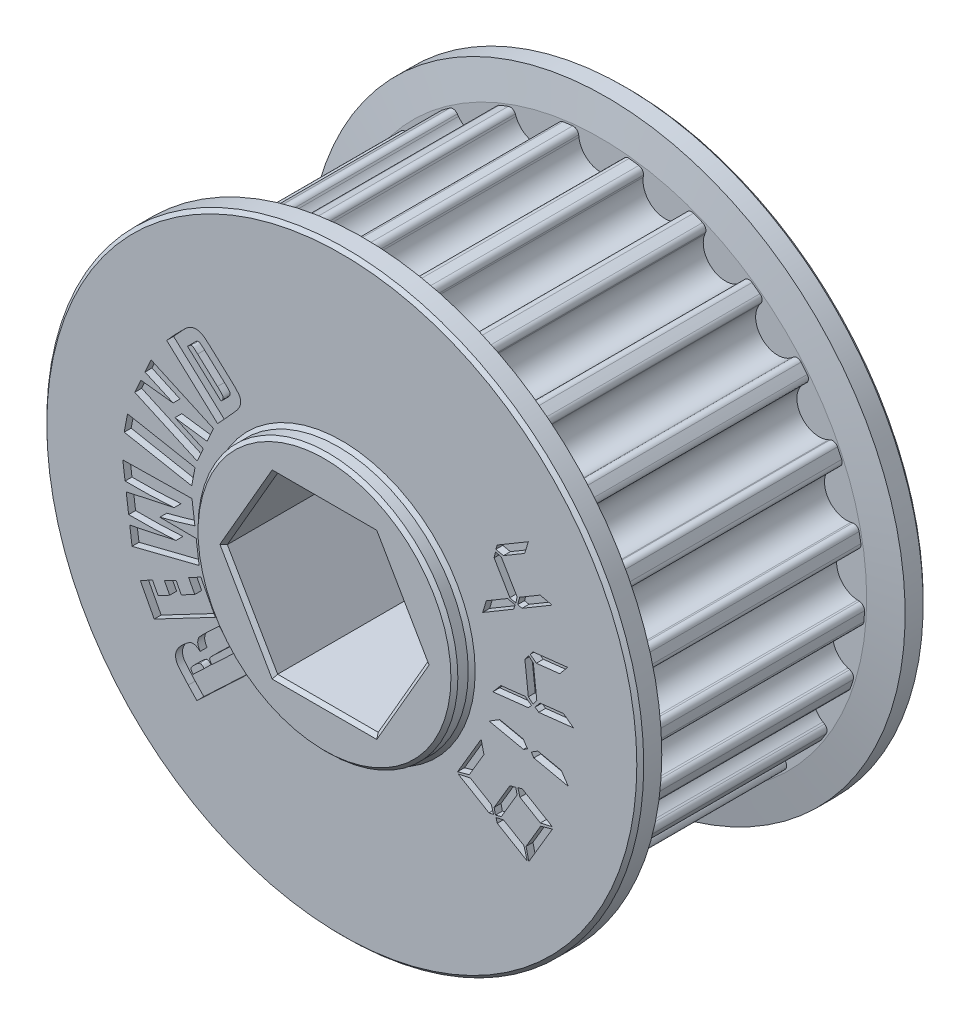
SolidWorks part; units mm, degrees
ref_plane "Front Plane" through (0, 0, 0) normal (0, 0, 1) x (1, 0, 0)
ref_plane "Top Plane" through (0, 0, 0) normal (0, 1, 0) x (1, 0, 0)
ref_plane "Right Plane" through (0, 0, 0) normal (1, 0, 0) x (0, 0, -1)
sketch "Sketch2" plane through (0, 0, 0) normal (0, 0, 1) x (1, 0, 0)
  circle A0 centre (0, 0) radius 19.3468
extrude "pulley" add sketch "Sketch2" along normal mid plane 17
sketch "tooth" plane through (0, 0, 0) normal (0, 0, 1) x (1, 0, 0)
  line L0 (0, 0) -> (0, 18.9468) construction
  line L1 (4.9563, 18.2871) -> (0, 18.9468) construction
  line L2 (4.9563, 18.2871) -> (0, 0) construction
  line L3 (-2.1327, 22.9824) -> (-1.6129, 18.7488)
  line L6 (2.1327, 22.9824) -> (1.6129, 18.7488)
  line L7 (-2.1327, 22.9824) -> (2.1327, 22.9824)
  arc A1 (-1.6129, 18.7488) -> (1.6129, 18.7488) centre (0, 18.9468) ccw
  arc A2 (0, 18.9468) -> (4.9563, 18.2871) centre (0, 0) cw construction
  circle A3 centre (4.9563, 18.2871) radius 1.625 construction
extrude "cut tooth" cut sketch "tooth" against normal mid plane 17
fillet "blend tooth" radius 0.4 2 edges at (1.6774, 19.274, 0) (-1.6774, 19.274, 0)
pattern_circular "tooth pattern" count 25 over 360 about axis through (0, 0, 0) along (0, 0, 1) of "cut tooth", "blend tooth"
sketch "Sketch3" plane through (0, 0, 0) normal (0, 0, 1) x (1, 0, 0)
  circle A0 centre (0, 0) radius 21.8868
  circle A1 centre (0, 0) radius 19.3468 construction
  dimension "D1" = 2.54
extrude "sidewall" add sketch "Sketch3" along normal blind 2 from offset 8.5
mirror "mirror sidewall" about plane through (0, 0, 0) normal (0, 0, 1) of "sidewall"
chamfer "sidewall chamfer" distance 2.4 angle 10 2 edges at (21.8868, 0, 8.5) (21.8868, 0, -8.5)
sketch "Sketch5" plane through (0, 0, 0) normal (0, 0, 1) x (1, 0, 0)
  circle A0 centre (0, 0) radius 9.525
  dimension "D1" = 19.05
extrude "bearing spacer (Manual Suppress)" add sketch "Sketch5" along normal blind 11.77 and the other way blind 11.77
sketch "Sketch4" plane through (0, 0, 0) normal (0, 0, 1) x (1, 0, 0)
  line L1 (3.6882, 6.3881) -> (-3.6882, 6.3881)
  line L2 (-3.6882, 6.3881) -> (-7.3763, 0)
  line L3 (-7.3763, 0) -> (-3.6882, -6.3881)
  line L4 (-3.6882, -6.3881) -> (3.6882, -6.3881)
  line L5 (3.6882, -6.3881) -> (7.3763, 0)
  line L6 (7.3763, 0) -> (3.6882, 6.3881)
  circle A0 centre (0, 0) radius 6.3881 construction
  dimension "D1" = 12.7762
extrude "hex shaft" cut sketch "Sketch4" against normal mid plane 127
chamfer "chamfers" distance 0.254 angle 45 18 edges at (21.8868, 0, -10.5) (21.8868, 0, 10.5) (-9.525, 0, -10.5) (9.525, 0, 10.5) (9.525, 0, 11.77) (0, 6.3881, 11.77) (-5.5323, 3.194, 11.77) (-5.5323, -3.194, 11.77) (0, -6.3881, 11.77) (5.5323, -3.194, 11.77) (5.5323, 3.1941, 11.77) (9.525, 0, -11.77) (0, -6.3881, -11.77) (-5.5323, -3.194, -11.77) (-5.5323, 3.194, -11.77) (0, 6.3881, -11.77) (5.5323, 3.1941, -11.77) (5.5323, -3.194, -11.77)
sketch "SK-VersaCut" plane through (0, 0, 0) normal (0, 0, 1) x (1, 0, 0)
  line B0 (6.3387, 23.6565) -> (5.299, 19.7762)
  line B1 (14.4772, 14.4772) -> (17.3177, 17.3177)
  line B2 (23.6565, 6.3387) -> (19.7762, 5.299)
  line B3 (19.7762, -5.299) -> (23.6565, -6.3387)
  line B4 (17.3177, -17.3177) -> (14.4772, -14.4772)
  line B5 (5.299, -19.7762) -> (6.3387, -23.6565)
  line B6 (-6.3387, -23.6565) -> (-5.299, -19.7762)
  line B7 (-14.4772, -14.4772) -> (-17.3177, -17.3177)
  line B8 (-23.6565, -6.3387) -> (-19.7762, -5.299)
  line B9 (-19.7762, 5.299) -> (-23.6565, 6.3387)
  line B10 (-17.3177, 17.3177) -> (-14.4772, 14.4772)
  line B11 (-5.299, 19.7762) -> (-6.3387, 23.6565)
  circle B12 centre (0, 23.8125) radius 2.2479
  arc B13 (5.9535, 18.5765) -> (13.1109, 14.4442) centre (0, 0) cw
  arc B14 (7.5904, 24.3458) -> (17.2889, 18.7464) centre (0, 0) cw
  arc B15 (5.9535, 18.5765) -> (5.299, 19.7762) centre (6.2559, 19.5198) cw
  arc B16 (13.1109, 14.4442) -> (14.4772, 14.4772) centre (13.7767, 15.1777) ccw
  arc B17 (17.2889, 18.7464) -> (17.3177, 17.3177) centre (16.6173, 18.0182) cw
  arc B18 (7.5904, 24.3458) -> (6.3387, 23.6565) centre (7.2956, 23.4001) ccw
  circle B19 centre (20.6222, 11.9062) radius 2.2479
  arc B20 (19.0645, 4.1323) -> (19.0645, -4.1323) centre (0, 0) cw
  arc B21 (24.8793, 5.5994) -> (24.8793, -5.5994) centre (0, 0) cw
  arc B22 (19.0645, 4.1323) -> (19.7762, 5.299) centre (20.0326, 4.3422) cw
  arc B23 (19.0645, -4.1323) -> (19.7762, -5.299) centre (20.0326, -4.3422) ccw
  arc B24 (24.8793, -5.5994) -> (23.6565, -6.3387) centre (23.9129, -5.3819) cw
  arc B25 (24.8793, 5.5994) -> (23.6565, 6.3387) centre (23.9129, 5.3819) ccw
  circle B26 centre (20.6222, -11.9063) radius 2.2479
  arc B27 (13.1109, -14.4442) -> (5.9535, -18.5765) centre (0, 0) cw
  arc B28 (17.2889, -18.7464) -> (7.5904, -24.3458) centre (0, 0) cw
  arc B29 (13.1109, -14.4442) -> (14.4772, -14.4772) centre (13.7767, -15.1777) cw
  arc B30 (5.9535, -18.5765) -> (5.299, -19.7762) centre (6.2559, -19.5198) ccw
  arc B31 (7.5904, -24.3458) -> (6.3387, -23.6565) centre (7.2956, -23.4001) cw
  arc B32 (17.2889, -18.7464) -> (17.3177, -17.3177) centre (16.6173, -18.0182) ccw
  circle B33 centre (0, -23.8125) radius 2.2479
  arc B34 (-5.9535, -18.5765) -> (-13.1109, -14.4442) centre (0, 0) cw
  arc B35 (-7.5904, -24.3458) -> (-17.2889, -18.7464) centre (0, 0) cw
  arc B36 (-5.9535, -18.5765) -> (-5.299, -19.7762) centre (-6.2559, -19.5198) cw
  arc B37 (-13.1109, -14.4442) -> (-14.4772, -14.4772) centre (-13.7767, -15.1777) ccw
  arc B38 (-17.2889, -18.7464) -> (-17.3177, -17.3177) centre (-16.6173, -18.0182) cw
  arc B39 (-7.5904, -24.3458) -> (-6.3387, -23.6565) centre (-7.2956, -23.4001) ccw
  circle B40 centre (-20.6222, -11.9063) radius 2.2479
  arc B41 (-19.0645, -4.1323) -> (-19.0645, 4.1323) centre (0, 0) cw
  arc B42 (-24.8793, -5.5994) -> (-24.8793, 5.5994) centre (0, 0) cw
  arc B43 (-19.0645, -4.1323) -> (-19.7762, -5.299) centre (-20.0326, -4.3422) cw
  arc B44 (-19.0645, 4.1323) -> (-19.7762, 5.299) centre (-20.0326, 4.3422) ccw
  arc B45 (-24.8793, 5.5994) -> (-23.6565, 6.3387) centre (-23.9129, 5.3819) cw
  arc B46 (-24.8793, -5.5994) -> (-23.6565, -6.3387) centre (-23.9129, -5.3819) ccw
  circle B47 centre (-20.6222, 11.9063) radius 2.2479
  arc B48 (-13.1109, 14.4442) -> (-5.9535, 18.5765) centre (0, 0) cw
  arc B49 (-17.2889, 18.7464) -> (-7.5904, 24.3458) centre (0, 0) cw
  arc B50 (-13.1109, 14.4442) -> (-14.4772, 14.4772) centre (-13.7767, 15.1777) cw
  arc B51 (-5.9535, 18.5765) -> (-5.299, 19.7762) centre (-6.2559, 19.5198) ccw
  arc B52 (-7.5904, 24.3458) -> (-6.3387, 23.6565) centre (-7.2956, 23.4001) cw
  arc B53 (-17.2889, 18.7464) -> (-17.3177, 17.3177) centre (-16.6173, 18.0182) ccw
sketch_block_instance "VersaKey-1"
sketch_block "Block1" parameters "D1"=47.625, "D2"=4.4958, "D3"=19.5072, "D4"=25.5016, "D6"=0.9906, "D5"=30
extrude "VersaKey (Manual Suppress)" [suppressed] cut sketch "SK-VersaCut" against normal through all both and the other way through all
sketch "Lightening Holes" plane through (0, 0, 0) normal (0, 0, 1) x (1, 0, 0)
  line L0 (-4.2823, 12.4972) -> (-3.9521, 11.9253)
  line L1 (3.9521, 11.9253) -> (4.2823, 12.4972)
  line L14 (0, 0) -> (-3.6662, 6.35) construction
  line L15 (0, 0) -> (0, 6.35) construction
  line L24 (0, 0) -> (3.6662, 6.35) construction
  line L25 (0, 6.35) -> (-3.6662, 6.35) construction
  line L26 (0, 6.35) -> (3.6662, 6.35) construction
  line L27 (-3.0943, 11.43) -> (3.0943, 11.43)
  line L28 (0, 6.35) -> (0, 11.43) construction
  line L29 (8.6817, 9.9572) -> (8.3515, 9.3853)
  line L30 (8.3515, 8.3947) -> (11.4458, 3.0353)
  line L31 (12.3037, 2.54) -> (12.9641, 2.54)
  line L32 (12.9641, -2.54) -> (12.3037, -2.54)
  line L33 (11.4458, -3.0353) -> (8.3515, -8.3947)
  line L34 (8.3515, -9.3853) -> (8.6817, -9.9572)
  line L35 (4.2823, -12.4972) -> (3.9521, -11.9253)
  line L36 (3.0943, -11.43) -> (-3.0943, -11.43)
  line L37 (-3.9521, -11.9253) -> (-4.2823, -12.4972)
  line L38 (-8.6817, -9.9572) -> (-8.3515, -9.3853)
  line L39 (-8.3515, -8.3947) -> (-11.4458, -3.0353)
  line L40 (-12.3037, -2.54) -> (-12.9641, -2.54)
  line L41 (-12.9641, 2.54) -> (-12.3037, 2.54)
  line L42 (-11.4458, 3.0353) -> (-8.3515, 8.3947)
  line L43 (-8.3515, 9.3853) -> (-8.6817, 9.9572)
  arc A3 (-3.6769, 13.9504) -> (3.6769, 13.9504) centre (0, 0) cw
  arc A4 (-3.0943, 11.43) -> (-3.9521, 11.9253) centre (-3.0943, 12.4206) cw
  arc A5 (3.0943, 11.43) -> (3.9521, 11.9253) centre (3.0943, 12.4206) ccw
  arc A6 (3.6769, 13.9504) -> (4.2823, 12.4972) centre (3.4244, 12.9925) cw
  arc A7 (-3.6769, 13.9504) -> (-4.2823, 12.4972) centre (-3.4244, 12.9925) ccw
  arc A72 (10.2429, 10.1595) -> (13.9199, 3.7909) centre (0, 0) cw
  arc A73 (10.2429, 10.1595) -> (8.6817, 9.9572) centre (9.5396, 9.4619) ccw
  arc A74 (8.3515, 8.3947) -> (8.3515, 9.3853) centre (9.2094, 8.89) cw
  arc A75 (13.9199, 3.7909) -> (12.9641, 2.54) centre (12.9641, 3.5306) cw
  arc A76 (13.9199, -3.7909) -> (10.2429, -10.1595) centre (0, 0) cw
  arc A77 (13.9199, -3.7909) -> (12.9641, -2.54) centre (12.9641, -3.5306) ccw
  arc A78 (11.4458, -3.0353) -> (12.3037, -2.54) centre (12.3037, -3.5306) cw
  arc A79 (10.2429, -10.1595) -> (8.6817, -9.9572) centre (9.5396, -9.4619) cw
  arc A80 (3.6769, -13.9504) -> (-3.6769, -13.9504) centre (0, 0) cw
  arc A81 (3.6769, -13.9504) -> (4.2823, -12.4972) centre (3.4244, -12.9925) ccw
  arc A82 (3.0943, -11.43) -> (3.9521, -11.9253) centre (3.0943, -12.4206) cw
  arc A83 (-3.6769, -13.9504) -> (-4.2823, -12.4972) centre (-3.4244, -12.9925) cw
  arc A84 (-10.2429, -10.1595) -> (-13.9199, -3.7909) centre (0, 0) cw
  arc A85 (-10.2429, -10.1595) -> (-8.6817, -9.9572) centre (-9.5396, -9.4619) ccw
  arc A86 (-8.3515, -8.3947) -> (-8.3515, -9.3853) centre (-9.2094, -8.89) cw
  arc A87 (-13.9199, -3.7909) -> (-12.9641, -2.54) centre (-12.9641, -3.5306) cw
  arc A88 (-13.9199, 3.7909) -> (-10.2429, 10.1595) centre (0, 0) cw
  arc A89 (-13.9199, 3.7909) -> (-12.9641, 2.54) centre (-12.9641, 3.5306) ccw
  arc A90 (-11.4458, 3.0353) -> (-12.3037, 2.54) centre (-12.3037, 3.5306) cw
  arc A91 (-10.2429, 10.1595) -> (-8.6817, 9.9572) centre (-9.5396, 9.4619) cw
  arc A92 (11.4458, 3.0353) -> (12.3037, 2.54) centre (12.3037, 3.5306) ccw
  arc A93 (8.3515, -8.3947) -> (8.3515, -9.3853) centre (9.2094, -8.89) ccw
  arc A94 (-3.0943, -11.43) -> (-3.9521, -11.9253) centre (-3.0943, -12.4206) ccw
  arc A95 (-11.4458, -3.0353) -> (-12.3037, -2.54) centre (-12.3037, -3.5306) ccw
  arc A96 (-8.3515, 8.3947) -> (-8.3515, 9.3853) centre (-9.2094, 8.89) ccw
  point P72 (0, 0)
  point P77 (0, 0)
  point P87 (0, 0)
extrude "Lightening Holes (Man Suppress)" [suppressed] cut sketch "Lightening Holes" against normal through all both and the other way through all
sketch "Sketch6" plane through (0, 0, 0) normal (0, 0, 1) x (1, 0, 0)
  line L0 (0, 11.1154) -> (0, 0) construction
  line L1 (0, 0) -> (0, -11.1154) construction
  arc A1 (0, 11.1154) -> (0, -11.1154) centre (0, 0) cw construction
  arc A2 (0, 11.1154) -> (0, -11.1154) centre (0, 0) ccw construction
  text T0 "4419" font "DS-Digital" height in points 24
  text T1 "REWIND" font "Impact" height in points 18
  point P5 (1.2366, 11.1154)
  point P6 (0, 0)
  point P7 (0, 0)
  point P9 (0, 0)
  point P10 (0, 0)
extrude "4419" cut sketch "Sketch6" along normal blind 2.54 from offset 9.992
equation "\"INPUT_pulley_teeth\"= 25"
equation "\"pulley_c2c\"= 5mm"
equation "\"pulley_teeth_deg\"= 360 / \"INPUT_pulley_teeth\""
equation "\"pulley_radius\"= ( \"pulley_c2c\" / ( 2 * cos ( \"iso_half_angle\" ) ) ) - 1mm"
equation "\"iso_half_angle\"= ( 180 - \"pulley_teeth_deg\" ) / 2"
equation "\"D1@tooth\" = \"pulley_radius\""
equation "\"pulley_tooth_dia\"= 3.25mm"
equation "\"D3@tooth\"=\"pulley_c2c\""
equation "\"D2@tooth\"=\"pulley_tooth_dia\""
equation "\"D1@Sketch2\"=2* \"pulley_radius\"+\"pulley_tooth_offset\""
equation "\"pulley_tooth_offset\"= .8mm"
equation "\"D1@tooth pattern\" = \"INPUT_pulley_teeth\""
equation "\"INPUT_pulley_belt_9_or_15_(unitless)\" = 15"
equation "\"D1@pulley\"=\"pulley_width\""
equation "\"D19@sidewall\" =  ( \"pulley_width\" / 2 ) "
equation "\"D1@sidewall\"=\"pulley_sidewall_thick\""
equation "\"pulley_width\"= IIF ( \"INPUT_pulley_belt_9_or_15_(unitless)\" = 9 , 11mm , 17mm )"
equation "\"D1@cut tooth\"=\"pulley_width\""
equation "\"D1@sidewall chamfer\" = 2.4mm"
equation "\"D4@Lightening Holes\"=\"pulley_radius\"-\"pulley_tooth_dia\"-.05"
equation "\"D1@bearing spacer (Manual Suppress)\" = 0.05 +  ( \"pulley_width\" / 2 )  + \"pulley_sidewall_thick\""
equation "\"D2@bearing spacer (Manual Suppress)\" = 0.05 +  ( \"pulley_width\" / 2 )  + \"pulley_sidewall_thick\""
equation "\"pulley_sidewall_thick\"= 2mm"
equation "\"D1@4419\" = \"pulley_width\""
equation "\"D19@4419\"=(\"pulley_width\" / 2) +\"pulley_sidewall_thick\" - 0.02"
equation "\"rad_len\" = \"INPUT_pulley_teeth\" * \"pulley_c2c\""
